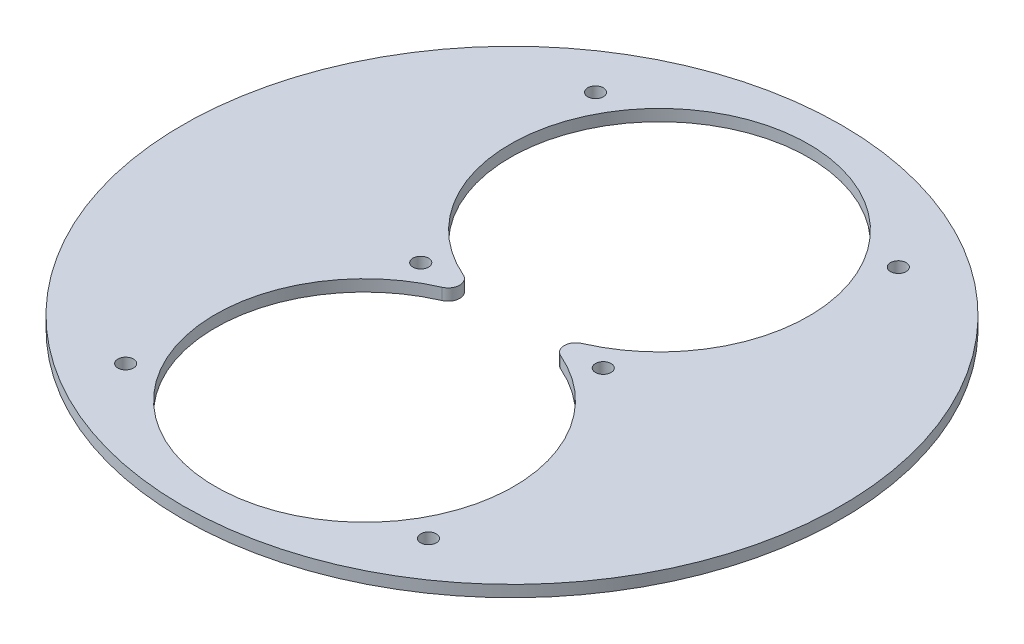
SolidWorks part; units mm, degrees
ref_plane "Front" through (0, 0, 0) normal (0, 0, 1) x (1, 0, 0)
ref_plane "Top" through (0, 0, 0) normal (0, 1, 0) x (1, 0, 0)
ref_plane "Right" through (0, 0, 0) normal (1, 0, 0) x (0, 0, -1)
sketch "Sketch1" plane through (0, 0, 0) normal (0, 1, 0) x (1, 0, 0)
  line L0 (0, 40.5) -> (0, -40.5) construction
  circle A0 centre (0, 0) radius 90.4875
  arc A3 (16.2722, 2.9137) -> (-16.2722, 2.9137) centre (0, 40.5) ccw
  arc A4 (-16.2722, -2.9137) -> (16.2722, -2.9137) centre (0, -40.5) ccw
  arc A5 (16.2722, 2.9137) -> (16.2722, -2.9137) centre (17.5336, 0) ccw
  arc A6 (-16.2722, -2.9137) -> (-16.2722, 2.9137) centre (-17.5336, 0) ccw
  point P7 (0, 0)
  point P12 (17.1392, 0)
  point P13 (17.7204, 0)
  dimension "D1" = 81.915
  dimension "D2" = 3.175
  dimension "D5" = 180.975
  dimension "D3" = 81
extrude "Boss-Extrude1" add sketch "Sketch1" along normal blind 3.175
hole_wizard "M4 Clearance Hole1" positions "Sketch8" profile "Sketch9" hole size "M4" standard "ANSI Metric"
sketch "Sketch8" plane through (0, 3.175, 0) normal (0, 1, 0) x (1, 0, 0)
  line L1 (-57.15, 50.8) -> (57.15, 50.8)
  line L2 (-57.15, 50.8) -> (-57.15, -50.8)
  line L3 (-57.15, -50.8) -> (57.15, -50.8)
  line L4 (57.15, 50.8) -> (57.15, -50.8)
  line L5 (57.15, 50.8) -> (-57.15, -50.8)
  point P0 (-57.15, -50.8)
  point P2 (-57.15, 50.8)
  point P4 (57.15, 50.8)
  point P6 (57.15, -50.8)
  point P171 (-57.15, 0)
  point P178 (0, 0)
  dimension "D1" = 101.6
  dimension "D2" = 114.3
sketch "Sketch9" plane through (-57.15, 3.175, 50.8) normal (1, 0, 0) x (0, 0, 1)
  line L0 (0, 0) -> (0, 11.3919)
  line L1 (0, 11.3919) -> (2.15, 10.1)
  line L2 (2.15, 10.1) -> (2.15, 0)
  line L5 (2.15, 0) -> (0, 0)
  line L10 (0, 11.3919) -> (-2.15, 10.1) construction
  line L11 (0, -6.35) -> (0, 107.95) construction
  dimension "Hole Dia." = 4.3
  dimension "Hole Depth" = 10.1
  dimension "Drill Angle" = 118
hole_wizard "M3x0.5 Tapped Hole1" positions "Sketch10" profile "Sketch11" tap size "M3x0.5" standard "ANSI Metric"
sketch "Sketch10" plane through (0, 3.175, 0) normal (0, 1, 0) x (1, 0, 0)
  point P0 (60.96, 24.003)
  point P3 (60.96, -24.003)
  point P6 (-60.96, -24.003)
  point P9 (-60.96, 24.003)
sketch "Sketch11" plane through (60.96, 3.175, -24.003) normal (1, 0, 0) x (0, 0, 1)
  line L0 (0, 0) -> (0, 8.2511)
  line L1 (0, 8.2511) -> (1.25, 7.5)
  line L2 (1.25, 7.5) -> (1.25, 0)
  line L5 (1.25, 0) -> (0, 0)
  line L10 (0, 8.2511) -> (-1.25, 7.5) construction
  line L11 (0, -6.35) -> (0, 107.95) construction
  dimension "Tap Drill Dia." = 2.5
  dimension "Tap Drill Depth" = 7.5
  dimension "Drill Angle" = 118
hole_wizard "M4 Clearance Hole2" positions "Sketch12" profile "Sketch13" hole size "M4" standard "ANSI Metric"
sketch "Sketch12" plane through (0, 0, 0) normal (0, -1, 0) x (-1, 0, 0)
  point P0 (-25.0577, 0)
  point P3 (25.0577, 0)
  point P6 (41.5692, -64.5)
  point P9 (-41.5692, -64.5)
  point P12 (-41.5692, 64.5)
  point P15 (41.5692, 64.5)
sketch "Sketch13" plane through (25.0577, 0, 0) normal (1, 0, 0) x (0, 0, -1)
  line L0 (0, 0) -> (0, 8.7918)
  line L1 (0, 8.7918) -> (2.15, 7.5)
  line L2 (2.15, 7.5) -> (2.15, 0)
  line L5 (2.15, 0) -> (0, 0)
  line L10 (0, 8.7918) -> (-2.15, 7.5) construction
  line L11 (0, -6.35) -> (0, 107.95) construction
  dimension "Hole Dia." = 4.3
  dimension "Hole Depth" = 7.5
  dimension "Drill Angle" = 118
